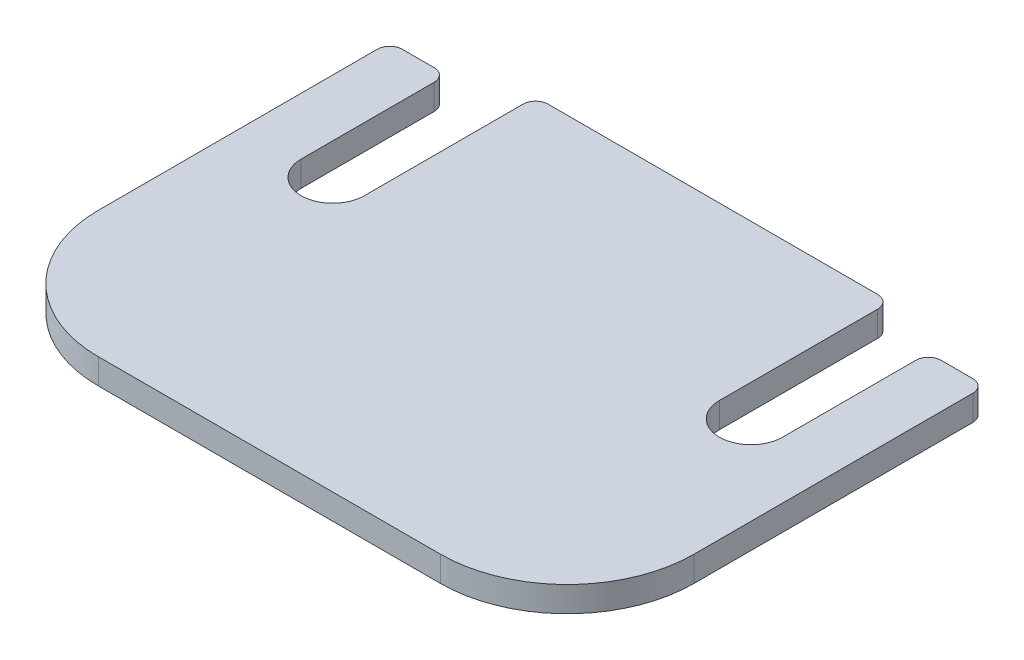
SolidWorks part; units mm, degrees
ref_plane "Plano frontal" through (0, 0, 0) normal (0, 0, 1) x (1, 0, 0)
ref_plane "Plano superior" through (0, 0, 0) normal (0, 1, 0) x (1, 0, 0)
ref_plane "Plano direito" through (0, 0, 0) normal (1, 0, 0) x (0, 0, -1)
sketch "Esboço1" plane through (0, 0, 0) normal (0, 1, 0) x (1, 0, 0)
  line L0 (-16.5, 17.5) -> (-16.5, 4) construction
  line L2 (-23.5, 14.5) -> (-23.5, -7.5)
  line L3 (-13.5, -17.5) -> (13.5, -17.5)
  line L4 (23.5, 14.5) -> (23.5, -7.5)
  line L5 (-23.5, 17.5) -> (23.5, -17.5) construction
  line L6 (-23.5, -17.5) -> (23.5, 17.5) construction
  line L7 (-14, 16.5) -> (-14, 4)
  line L8 (-19, 14.5) -> (-19, 4)
  line L9 (16.5, 17.5) -> (16.5, 4) construction
  line L10 (19, 14.5) -> (19, 4)
  line L11 (14, 16.5) -> (14, 4)
  line L12 (0, 0) -> (0, 20.1035) construction
  line L13 (20, 15.5) -> (22.5, 15.5)
  line L14 (-20, 15.5) -> (-22.5, 15.5)
  line L15 (-13, 17.5) -> (13, 17.5)
  arc A0 (13.5, -17.5) -> (23.5, -7.5) centre (13.5, -7.5) ccw
  arc A1 (-23.5, -7.5) -> (-13.5, -17.5) centre (-13.5, -7.5) ccw
  arc A2 (22.5, 15.5) -> (23.5, 14.5) centre (22.5, 14.5) cw
  arc A3 (-19, 4) -> (-14, 4) centre (-16.5, 4) ccw
  arc A4 (20, 15.5) -> (19, 14.5) centre (20, 14.5) ccw
  arc A5 (14, 4) -> (19, 4) centre (16.5, 4) ccw
  arc A6 (14, 16.5) -> (13, 17.5) centre (13, 16.5) ccw
  arc A7 (-14, 16.5) -> (-13, 17.5) centre (-13, 16.5) cw
  arc A8 (-20, 15.5) -> (-19, 14.5) centre (-20, 14.5) cw
  arc A9 (-22.5, 15.5) -> (-23.5, 14.5) centre (-22.5, 14.5) ccw
  point P0 (0, 0)
  point P14 (-16.5, 10.75)
  point P19 (16.5, 10.75)
  point P34 (19, 15.5)
  point P41 (-19, 15.5)
  dimension "D3" = 10
  dimension "D7" = 1
  dimension "D1" = 47
  dimension "D2" = 16
  dimension "D4" = 5
  dimension "D5" = 5
  dimension "D6" = 28
  dimension "D8" = 33
extrude "Ressalto-extrusão1" add sketch "Esboço1" along normal blind 2
